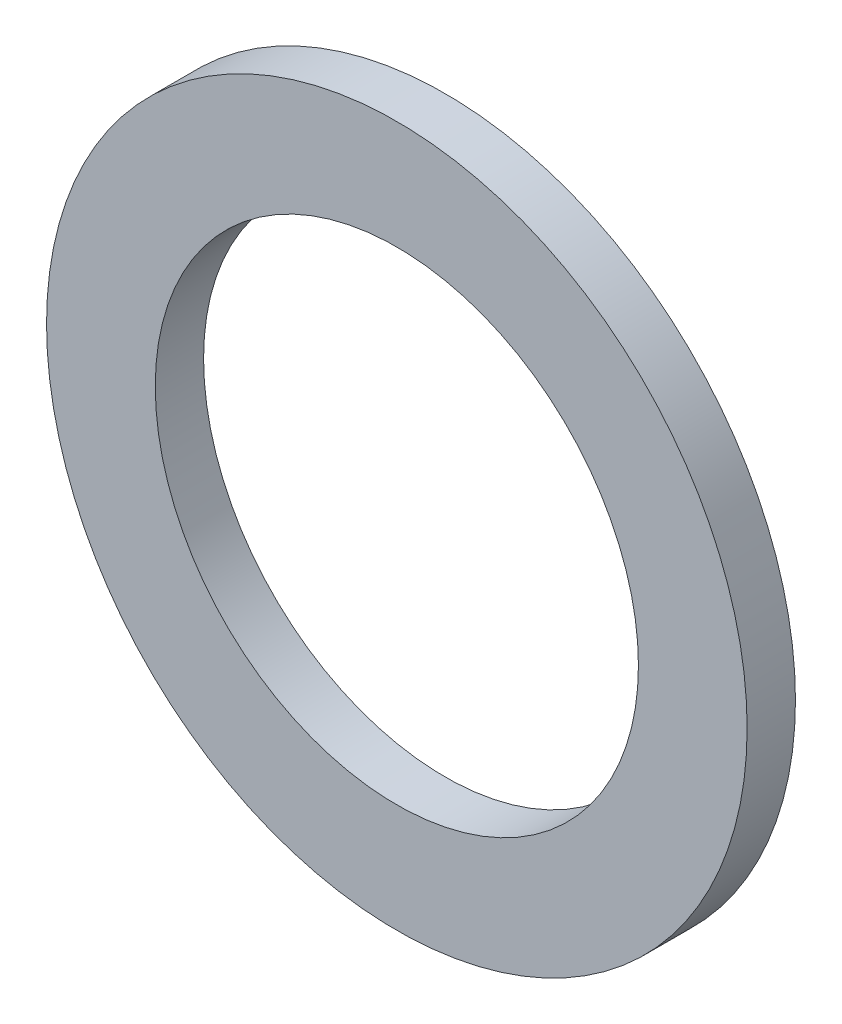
SolidWorks part; units mm, degrees
ref_plane "前视基准面" through (0, 0, 0) normal (0, 0, 1) x (1, 0, 0)
ref_plane "上视基准面" through (0, 0, 0) normal (0, 1, 0) x (1, 0, 0)
ref_plane "右视基准面" through (0, 0, 0) normal (1, 0, 0) x (0, 0, -1)
sketch "草图1" plane through (0, 0, 0) normal (0, 0, 1) x (1, 0, 0)
  circle A0 centre (4.5, 0) radius 10
  circle A1 centre (4.5, 0) radius 14.5
  circle A2 centre (4.5, 0) radius 14.5 construction
  circle A3 centre (4.5, 0) radius 9 construction
  dimension "D1" = 1
extrude "拉伸1" add sketch "草图1" against normal up to surface (2 mm away)
